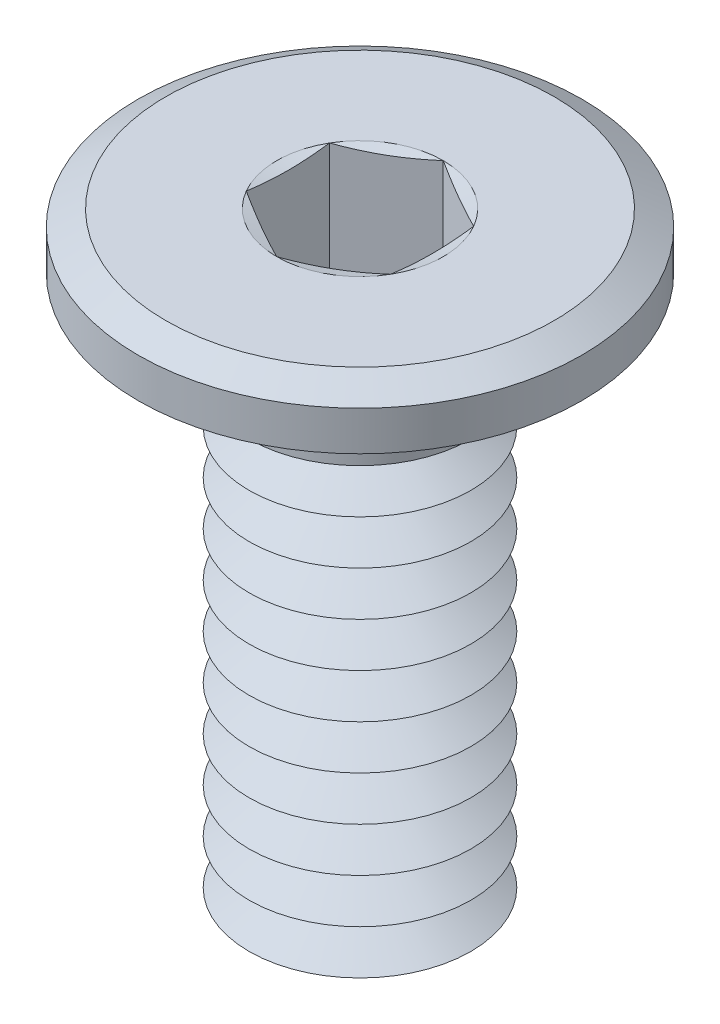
SolidWorks part; units mm, degrees
ref_plane "Front Plane" through (0, 0, 0) normal (0, 0, 1) x (1, 0, 0)
ref_plane "Top Plane" through (0, 0, 0) normal (0, 1, 0) x (1, 0, 0)
ref_plane "Right Plane" through (0, 0, 0) normal (1, 0, 0) x (0, 0, -1)
sketch "Sketch1" plane through (0, 0, 0) normal (0, 1, 0) x (1, 0, 0)
  circle A0 centre (0, 0) radius 2
  dimension "D1" = 4
extrude "Boss-Extrude1" add sketch "Sketch1" against normal blind 0.5
sketch "Sketch2" plane through (0, -0.5, 0) normal (0, -1, 0) x (1, 0, 0)
  circle A0 centre (0, 0) radius 1
  dimension "D1" = 2
extrude "Boss-Extrude2" add sketch "Sketch2" along normal blind 5
sketch "Sketch3" plane through (0, 0, 0) normal (1, 0, 0) x (0, 0, -1)
  line L0 (0, 0.9906) -> (0, -8.2999) construction
sketch "Sketch5" plane through (0, 0, 0) normal (1, 0, 0) x (0, 0, -1)
  line L0 (-1, -5.7) -> (-0.6536, -5.5)
  line L1 (-1, -0.5) -> (-1, -5.5) construction
  line L2 (-0.6536, -5.5) -> (-1, -5.3)
  line L3 (-1, -0.5) -> (-1, -5.5) construction
  line L4 (-1, -5.3) -> (-1, -5.7)
  line L6 (-1, -0.5) -> (-1, -5.5) construction
  line L7 (-1, -0.5) -> (-1, -5.5) construction
  line L14 (-1, -5.5) -> (1, -5.5) construction
  dimension "D1" = 0.4
revolve "Cut-Revolve1" cut sketch "Sketch5" angle 360 about L0
pattern_linear "LPattern1" count 11 spacing 0.4 along (0, 1, 0) of "Cut-Revolve1"
fillet "Fillet1" radius 0.1 1 edges at (0, -0.5, -1)
chamfer "Chamfer2" distance 0.25 angle 30 1 edges at (0, 0, 2)
sketch "Sketch6" plane through (0, 0, 0) normal (0, 1, 0) x (1, 0, 0)
  line L1 (0, 0.7506) -> (-0.65, 0.3753)
  line L2 (-0.65, 0.3753) -> (-0.65, -0.3753)
  line L3 (-0.65, -0.3753) -> (0, -0.7506)
  line L4 (0, -0.7506) -> (0.65, -0.3753)
  line L5 (0.65, -0.3753) -> (0.65, 0.3753)
  line L6 (0.65, 0.3753) -> (0, 0.7506)
  circle A0 centre (0, 0) radius 0.65 construction
  dimension "D1" = 1.3
extrude "Cut-Extrude1" cut sketch "Sketch6" against normal blind 1.2
sketch "Sketch7" plane through (0, -1.2, 0) normal (0, 1, 0) x (1, 0, 0)
  line L0 (-0.65, 0.3753) -> (-0.65, -0.3753) construction
  circle A0 centre (0, 0) radius 0.65
extrude "Cut-Extrude2" cut sketch "Sketch7" against normal through all draft 60
sketch "Sketch8" plane through (0, 0, 0) normal (0, 1, 0) x (1, 0, 0)
  circle A0 centre (0, 0) radius 0.7506
extrude "Cut-Extrude3" cut sketch "Sketch8" against normal through all draft 75
